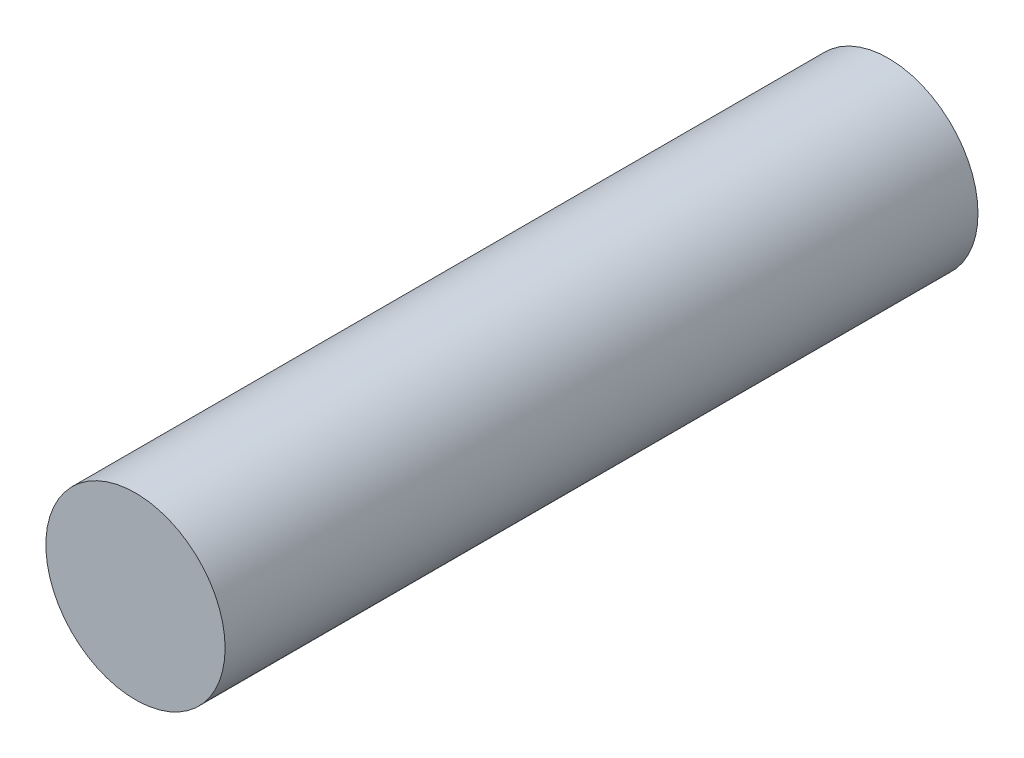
SolidWorks part; units mm, degrees
ref_plane "Front Plane" through (0, 0, 0) normal (0, 0, 1) x (1, 0, 0)
ref_plane "Top Plane" through (0, 0, 0) normal (0, 1, 0) x (1, 0, 0)
ref_plane "Right Plane" through (0, 0, 0) normal (1, 0, 0) x (0, 0, -1)
sketch "Sketch1" plane through (0, 0, 0) normal (0, 0, 1) x (1, 0, 0)
  circle A0 centre (0, 0) radius 1
  dimension "D1" = 2
extrude "Boss-Extrude1" add sketch "Sketch1" along normal mid plane 8.4
